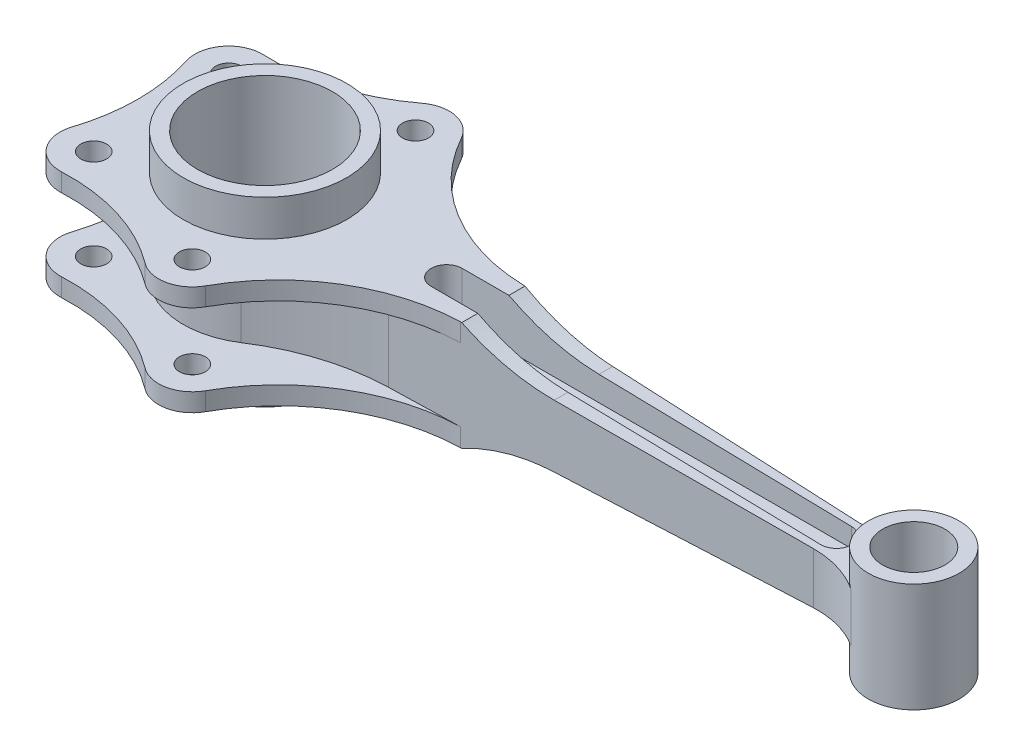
SolidWorks part; units mm, degrees
ref_plane "Front Plane" through (0, 0, 0) normal (0, 0, 1) x (1, 0, 0)
ref_plane "Top Plane" through (0, 0, 0) normal (0, 1, 0) x (1, 0, 0)
ref_plane "Right Plane" through (0, 0, 0) normal (1, 0, 0) x (0, 0, -1)
sketch "Sketch1" plane through (0, 0, 0) normal (0, 1, 0) x (1, 0, 0)
  circle A0 centre (0, 0) radius 31.5
  dimension "D1" = 63
extrude "Boss-Extrude1" add sketch "Sketch1" along normal blind 35
sketch "Sketch2" plane through (0, 0, 0) normal (0, 1, 0) x (1, 0, 0)
  line L0 (0, -34.65) -> (0, 34.65) construction
  line L1 (-34.65, 0) -> (34.65, 0) construction
  circle A0 centre (250, 0) radius 17.5
  dimension "D1" = 35
  dimension "D2" = 250
extrude "Boss-Extrude2" add sketch "Sketch2" along normal blind 21 separate body
sketch "Sketch3" plane through (0, 0, 0) normal (0, 1, 0) x (1, 0, 0)
  line L0 (220, 8.7199) -> (60.4309, 12.8984)
  line L1 (220, -8.7199) -> (60.4309, -12.8984)
  line L3 (60.4309, -12.8984) -> (60.4309, 12.8984) construction
  line L4 (220, -8.7199) -> (220, 8.7199) construction
  line L5 (0, 0) -> (250, 0) construction
  circle A0 centre (250, 0) radius 17.5 construction
  arc A1 (60.4309, 12.8984) -> (17.2228, 26.3747) centre (62.6036, 95.8699) cw
  circle A2 centre (0, 0) radius 31.5 construction
  arc A3 (17.2228, -26.3747) -> (60.4309, -12.8984) centre (62.6036, -95.8699) cw
  arc A4 (220, 8.7199) -> (240.3054, 14.5693) centre (220.9162, 43.7079) ccw
  arc A5 (220, -8.7199) -> (240.3054, -14.5693) centre (220.9162, -43.7079) cw
  arc A6 (17.2228, 26.3747) -> (17.2228, -26.3747) centre (0, 0) ccw
  arc A7 (240.3054, -14.5693) -> (240.3054, 14.5693) centre (250, 0) ccw
  dimension "D6" = 30
  dimension "D3" = 83
  dimension "D4" = 35
  dimension "D1" = 3
extrude "Boss-Extrude3" add sketch "Sketch3" along normal blind 21
sketch "Sketch6" plane through (0, 21, 0) normal (0, 1, 0) x (1, 0, 0)
  line L0 (0, -19.25) -> (0, 19.25) construction
  line L1 (-38.5, 0) -> (38.5, 0) construction
  line L3 (220, 8.7199) -> (60.4309, 12.8984) construction
  line L4 (-48.9259, 0) -> (310.645, 0) construction
  line L5 (87.482, 12.19) -> (87.482, -12.19)
  arc A0 (-52.3769, 22.0235) -> (-52.3769, -22.0235) centre (-120.9259, 0) cw
  arc A1 (-39.4063, 38.9864) -> (-52.3769, 22.0235) centre (-40, 26) ccw
  arc A2 (26.3737, 49.2959) -> (7.1819, 53.3864) centre (15, 43) ccw
  arc A3 (-39.4063, 38.9864) -> (7.1819, 53.3864) centre (-36.118, 110.9113) ccw
  arc A4 (26.3737, 49.2959) -> (87.482, 12.19) centre (89.3668, 84.1653) ccw
  arc A6 (-39.4063, -38.9864) -> (-52.3769, -22.0235) centre (-40, -26) cw
  arc A7 (-39.4063, -38.9864) -> (7.1819, -53.3864) centre (-36.118, -110.9113) cw
  arc A8 (26.3737, -49.2959) -> (7.1819, -53.3864) centre (15, -43) cw
  arc A9 (26.3737, -49.2959) -> (87.482, -12.19) centre (89.3668, -84.1653) cw
  circle A10 centre (15, 43) radius 5 construction
  circle A11 centre (-40, 26) radius 5 construction
  circle A12 centre (-40, -26) radius 5 construction
  circle A13 centre (15, -43) radius 5 construction
  dimension "D1" = 72
  dimension "D2" = 13
  dimension "D3" = 40
  dimension "D7" = 10
  dimension "D8" = 72
  dimension "D4" = 26
  dimension "D5" = 17
  dimension "D6" = 15
  dimension "D9" = 74.3668
  dimension "D10" = 41.1653
extrude "Boss-Extrude4" add sketch "Sketch6" against normal blind 7
sketch "Sketch4" plane through (0, 0, 0) normal (0, 1, 0) x (1, 0, 0)
  line L0 (-38.5, 0) -> (38.5, 0) construction
  line L1 (70, 6) -> (220, 6)
  line L2 (70, 6) -> (70, -6) construction
  line L3 (70, -6) -> (220, -6)
  line L4 (220, 6) -> (220, -6) construction
  arc A0 (220, 6) -> (220, -6) centre (220, 0) cw
  arc A1 (70, -6) -> (70, 6) centre (70, 0) cw
  arc A2 (240.3054, -14.5693) -> (240.3054, 14.5693) centre (250, 0) ccw construction
  dimension "D1" = 12
  dimension "D2" = 6
  dimension "D3" = 30
  dimension "D4" = 150
extrude "Cut-Extrude1" cut sketch "Sketch4" along normal through all from offset 2.5
sketch "Sketch5" plane through (0, 0, 0) normal (0, 0, 1) x (1, 0, 0)
  line L0 (122.7067, 12) -> (288, 8.3933)
  line L2 (145.6036, 21) -> (-20.3964, 21) construction
  line L3 (0, -19.25) -> (0, 19.25) construction
  line L4 (34.65, 0) -> (-34.65, 0) construction
  line L5 (88, 21) -> (288, 21)
  line L6 (288, 21) -> (288, 8.3933)
  arc A0 (122.7067, 12) -> (88, 21) centre (124.4083, 89.9814) cw
  dimension "D2" = 78
  dimension "D1" = 1.25
  dimension "D3" = 88
  dimension "D4" = 12
  dimension "D5" = 288
extrude "Cut-Extrude2" cut sketch "Sketch5" against normal through all and the other way through all
sketch "Sketch7" plane through (0, 0, 0) normal (0, 1, 0) x (1, 0, 0)
  circle A0 centre (250, 0) radius 17.5
  arc A1 (240.3054, -14.5693) -> (240.3054, 14.5693) centre (250, 0) ccw construction
extrude "Boss-Extrude5" add sketch "Sketch7" along normal blind 21
hole_wizard "Ø10.0 (10) Diameter Hole2" positions "Sketch18" profile "Sketch17" hole size "Ø10.0" standard "ISO"
sketch "Sketch18" plane through (0, 21, 0) normal (0, 1, 0) x (-1, 0, 0)
  arc A0 (-26.3737, -49.2959) -> (-7.1819, -53.3864) centre (-15, -43) ccw construction
  point P0 (-15, -43)
sketch "Sketch17" plane through (15, 21, -43) normal (1, 0, 0) x (0, 0, 1)
  line L0 (0, 0) -> (0, 13.0043)
  line L1 (0, 13.0043) -> (5, 10)
  line L2 (5, 10) -> (5, 0)
  line L5 (5, 0) -> (0, 0)
  line L10 (0, 13.0043) -> (-5, 10) construction
  line L11 (0, -6.35) -> (0, 107.95) construction
  dimension "Hole Dia." = 10
  dimension "Hole Depth" = 10
  dimension "Drill Angle" = 118
sketch "Sketch16" plane through (0, 21, 0) normal (0, 1, 0) x (1, 0, 0)
  point P0 (-40, 26)
  point P1 (-40, -26)
  point P3 (15, -43)
pattern_sketch "Sketch-Pattern1" of "Ø10.0 (10) Diameter Hole2"
mirror "Mirror1" about plane through (0, 0, 0) normal (0, 1, 0) of "Sketch-Pattern1", "Ø10.0 (10) Diameter Hole2", "Boss-Extrude5", "Cut-Extrude2", "Cut-Extrude1", "Boss-Extrude4", "Boss-Extrude3", "Boss-Extrude1"
sketch "Sketch8" plane through (0, 0, 0) normal (0, 1, 0) x (1, 0, 0)
  circle A0 centre (0, 0) radius 26
  circle A1 centre (250, 0) radius 12
  dimension "D1" = 52
  dimension "D2" = 24
extrude "Cut-Extrude3" cut sketch "Sketch8" against normal through all and the other way through all
